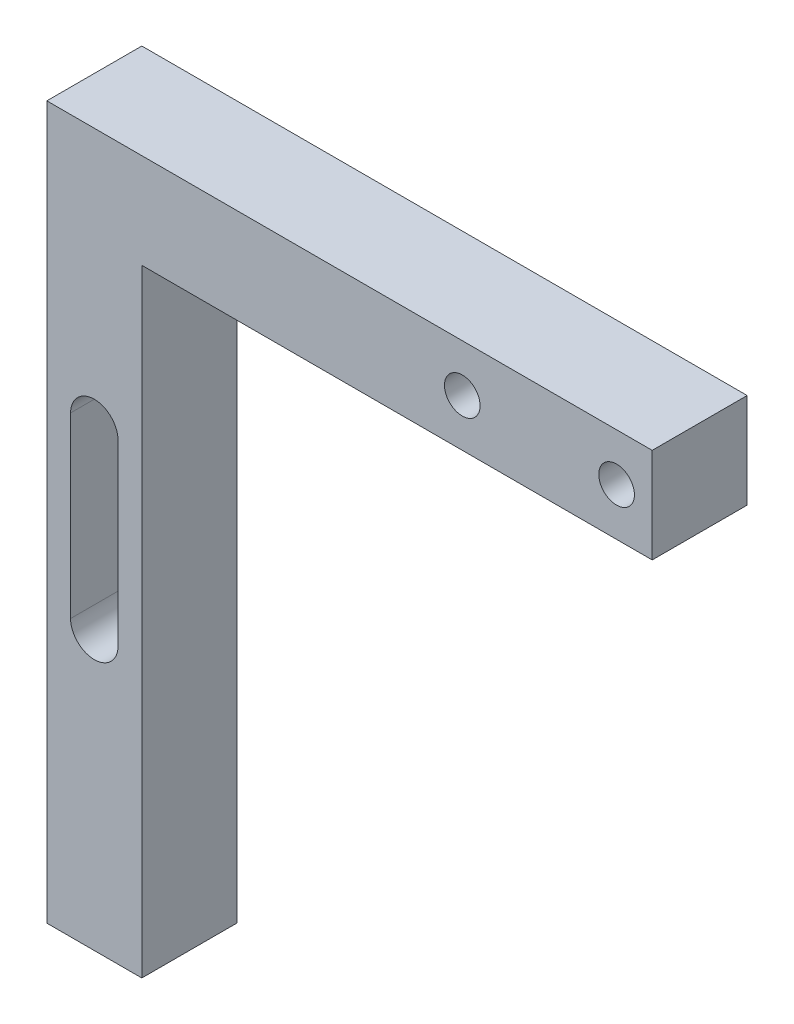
SolidWorks part; units mm, degrees
ref_plane "前视基准面" through (0, 0, 0) normal (0, 0, 1) x (1, 0, 0)
ref_plane "上视基准面" through (0, 0, 0) normal (0, 1, 0) x (1, 0, 0)
ref_plane "右视基准面" through (0, 0, 0) normal (1, 0, 0) x (0, 0, -1)
sketch "草图4" plane through (0, 0, 0) normal (0, 0, 1) x (1, 0, 0)
  line L0 (0, 0) -> (51, 0)
  line L1 (51, 0) -> (51, -8)
  line L2 (51, -8) -> (8, -8)
  line L3 (8, -8) -> (8, -60)
  line L4 (8, -60) -> (0, -60)
  line L5 (0, -60) -> (0, 0)
  line L6 (51, -4) -> (28.9908, -4) construction
  line L7 (4, -60) -> (4, -12.3824) construction
  line L8 (4, -21.7713) -> (4, -36.7713) construction
  line L9 (6, -21.7713) -> (6, -36.7713)
  line L10 (2, -21.7713) -> (2, -36.7713)
  circle A0 centre (48, -4) radius 1.5
  circle A1 centre (35, -4) radius 1.5
  arc A2 (6, -21.7713) -> (2, -21.7713) centre (4, -21.7713) ccw
  arc A3 (2, -36.7713) -> (6, -36.7713) centre (4, -36.7713) ccw
  point P17 (4, -29.2713)
  dimension "D8" = 3
  dimension "D9" = 3
  dimension "D11" = 2
  dimension "D1" = 8
  dimension "D2" = 51
  dimension "D3" = 43
  dimension "D4" = 8
  dimension "D5" = 60
  dimension "D6" = 13
  dimension "D7" = 3
  dimension "D10" = 15
extrude "凸台-拉伸2" add sketch "草图4" along normal blind 8
sketch "草图5" plane through (0, -60, 0) normal (0, -1, 0) x (1, 0, 0)
  line L0 (0, 8) -> (8, 0) construction
  circle A0 centre (4, 4) radius 1.5
  dimension "D1" = 3
extrude "切除-拉伸2" cut sketch "草图5" against normal blind 20
